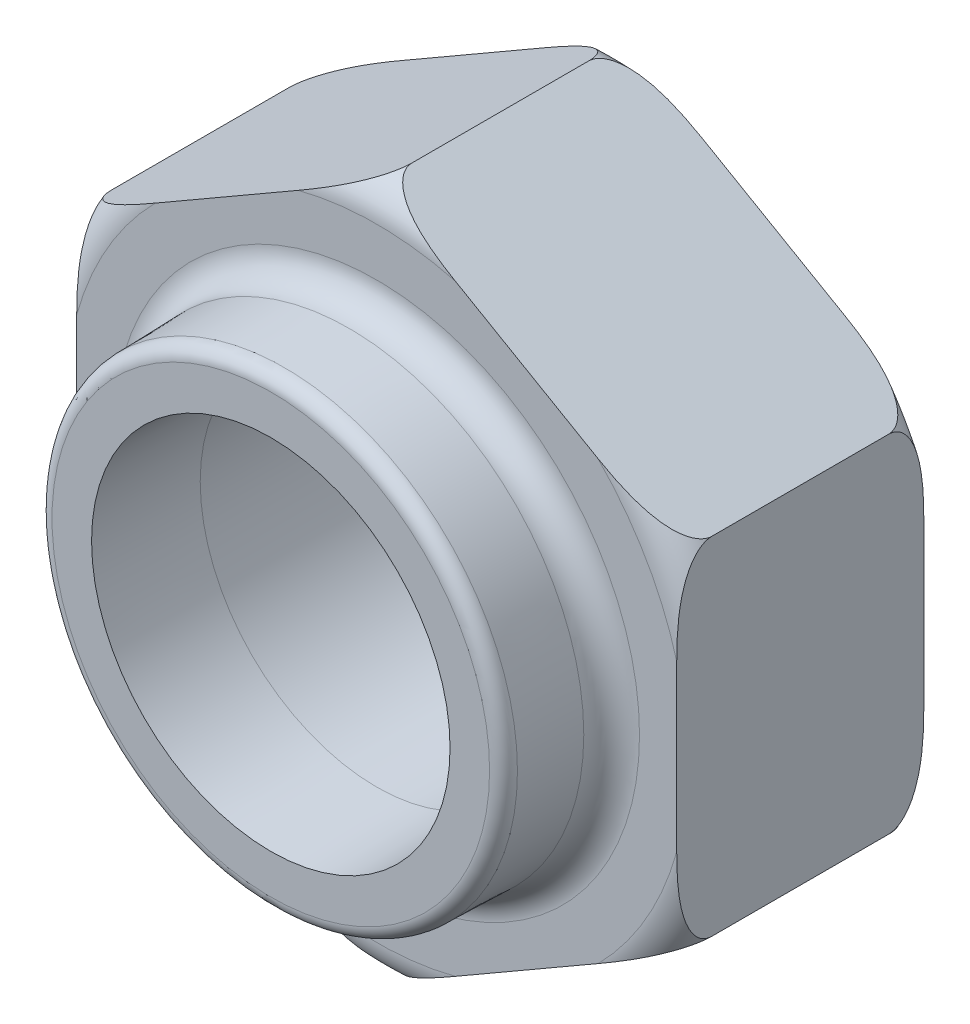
SolidWorks part; units mm, degrees
ref_plane "Face" through (0, 0, 0) normal (0, 0, 1) x (1, 0, 0)
ref_plane "Gauche" through (0, 0, 0) normal (0, 1, 0) x (1, 0, 0)
ref_plane "Dessus" through (0, 0, 0) normal (1, 0, 0) x (0, 0, -1)
sketch "Esquisse1" plane through (0, 0, 0) normal (0, 0, 1) x (1, 0, 0)
  line L0 (0, 0) -> (-49.3312, 0) construction
  line L1 (0, 0) -> (0, -43.0886) construction
  line L2 (-8.5, 4.9075) -> (-8.5, -4.9075)
  line L3 (8.5, 4.9075) -> (8.5, -4.9075)
  line L4 (-8.5, -4.9075) -> (0, -9.815)
  line L5 (8.5, -4.9075) -> (0, -9.815)
  line L7 (-8.5, 4.9075) -> (0, 9.815)
  line L9 (8.5, 4.9075) -> (0, 9.815)
  point P14 (-8.5, 0)
  point P17 (8.5, 0)
  dimension "D1" = 17
  dimension "A" = 17
  dimension "D3" = 17
  dimension "D4" = 30
extrude "Tete" add sketch "Esquisse1" along normal blind 7
sketch "Esquisse2" plane through (0, 0, 0) normal (1, 0, 0) x (0, 0, -1)
  line L0 (0, 0) -> (-68.4114, 0) construction
  line L1 (0, -4.9075) -> (0, -9.815) construction
  line L2 (-7, -9.815) -> (0, -9.815) construction
  line L3 (-1, -9.815) -> (-1, -19.815)
  line L4 (8.7711, -19.815) -> (-1, -19.815)
  line L5 (0, -8.815) -> (8.7711, -8.815)
  line L7 (8.7711, -8.815) -> (8.7711, -19.815)
  arc A0 (-1, -9.815) -> (0, -8.815) centre (-1, -8.815) ccw
  dimension "R" = 1
  dimension "D2" = 8.7711
  dimension "D3" = 10
revolve "Rayon de tete" cut sketch "Esquisse2" angle 360 about L0
ref_plane "Plan1" through (0, 0, 3.5) normal (0, 0, 1) x (1, 0, 0)
mirror "Symétrie1" about plane through (0, 0, 3.5) normal (0, 0, 1) of "Rayon de tete"
sketch "Esquisse3" plane through (0, 0, 0) normal (0, 0, -1) x (-1, 0, 0)
  circle A0 centre (0, 0) radius 5
  dimension "D" = 10
extrude "Enlèv. de mat.-Extru.1" cut sketch "Esquisse3" against normal through all
sketch "Esquisse4" plane through (0, 0, 7) normal (0, 0, 1) x (1, 0, 0)
  circle A0 centre (0, 0) radius 6.6667
  circle A1 centre (0, 0) radius 5 construction
  circle A2 centre (0, 0) radius 5
  dimension "Dn" = 13.3333
extrude "Boss.-Extru.1" add sketch "Esquisse4" along normal blind 3 draft 1.5
fillet "Congé1" radius 0.8 1 edges at (6.6667, 0, 7)
fillet "Congé3" radius 0.4 1 edges at (6.5881, 0, 10)
equation "\"D1@Esquisse1\" = \"A@Esquisse1\""
equation "\"D3@Esquisse1\" = \"A@Esquisse1\""
equation "\"D1@Plan1\" = \"B@Tete\"/2"
equation "\"Dn@Esquisse4\" = \"D@Esquisse3\"+ \"D@Esquisse3\"/3"
equation "\"Ra@Congé1\" = \"R@Esquisse2\"*0.8"
equation "\"D1@Congé3\" = \"Ra@Congé1\"/2"
